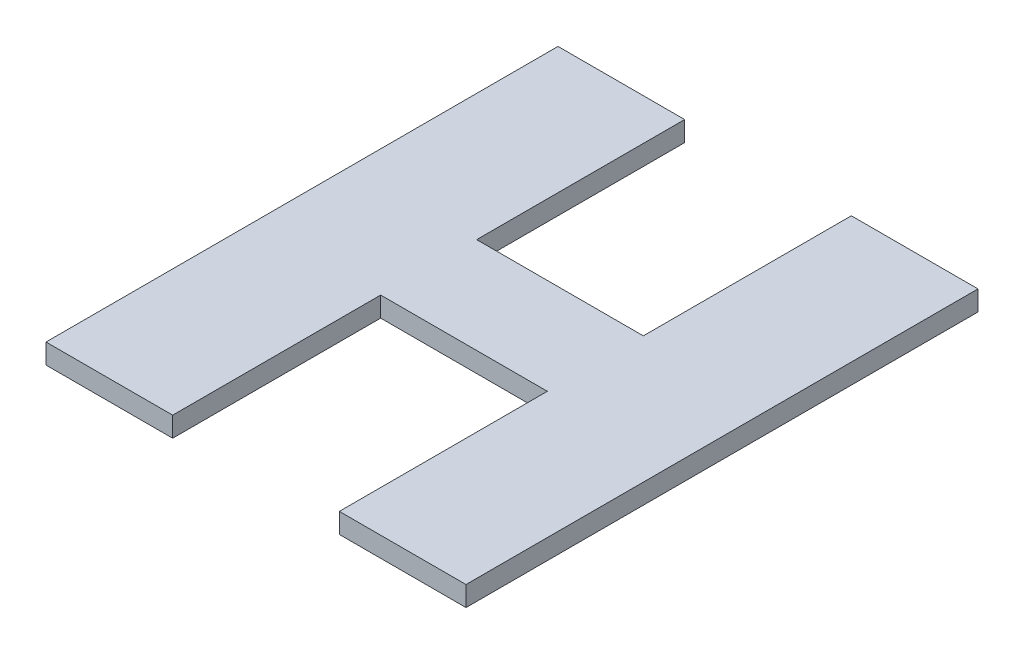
SolidWorks part; units mm, degrees
ref_plane "Front/Back" through (0, 0, 0) normal (0, 0, 1) x (1, 0, 0)
ref_plane "Top/Bottom" through (0, 0, 0) normal (0, 1, 0) x (1, 0, 0)
ref_plane "Right/Left" through (0, 0, 0) normal (1, 0, 0) x (0, 0, -1)
sketch "Sketch1" plane through (0, 0, 0) normal (0, 1, 0) x (1, 0, 0)
  line L0 (0, 0) -> (8.001, 0) construction
  line L1 (-8.001, 9.7536) -> (8.001, 9.7536)
  line L2 (-8.001, 9.7536) -> (-8.001, -9.7536)
  line L3 (-8.001, -9.7536) -> (8.001, -9.7536)
  line L4 (8.001, 9.7536) -> (8.001, -9.7536)
  line L5 (0, 0) -> (0, 9.7536) construction
  dimension "D1" = 16.002
  dimension "D2" = 19.5072
extrude "Extrude1" add sketch "Sketch1" along normal mid plane 0.762
sketch "Sketch2" plane through (0, 0.381, 0) normal (0, 1, 0) x (-1, 0, 0)
  line L0 (8.001, 9.7536) -> (-8.001, 9.7536) construction
  line L1 (-3.175, 9.7536) -> (3.175, 9.7536)
  line L2 (-3.175, 9.7536) -> (-3.175, 1.8288)
  line L3 (-3.175, 1.8288) -> (3.175, 1.8288)
  line L4 (3.175, 9.7536) -> (3.175, 1.8288)
  line L5 (0, 0) -> (0, 10.6329) construction
  line L6 (0, 0) -> (8.392, 0) construction
  line L7 (3.175, -9.7536) -> (3.175, -1.8288)
  line L8 (-3.175, -1.8288) -> (3.175, -1.8288)
  line L9 (-3.175, -9.7536) -> (-3.175, -1.8288)
  line L10 (-3.175, -9.7536) -> (3.175, -9.7536)
  dimension "D1" = 7.9248
  dimension "D2" = 6.35
extrude "Cut-Extrude1" cut sketch "Sketch2" against normal through all
